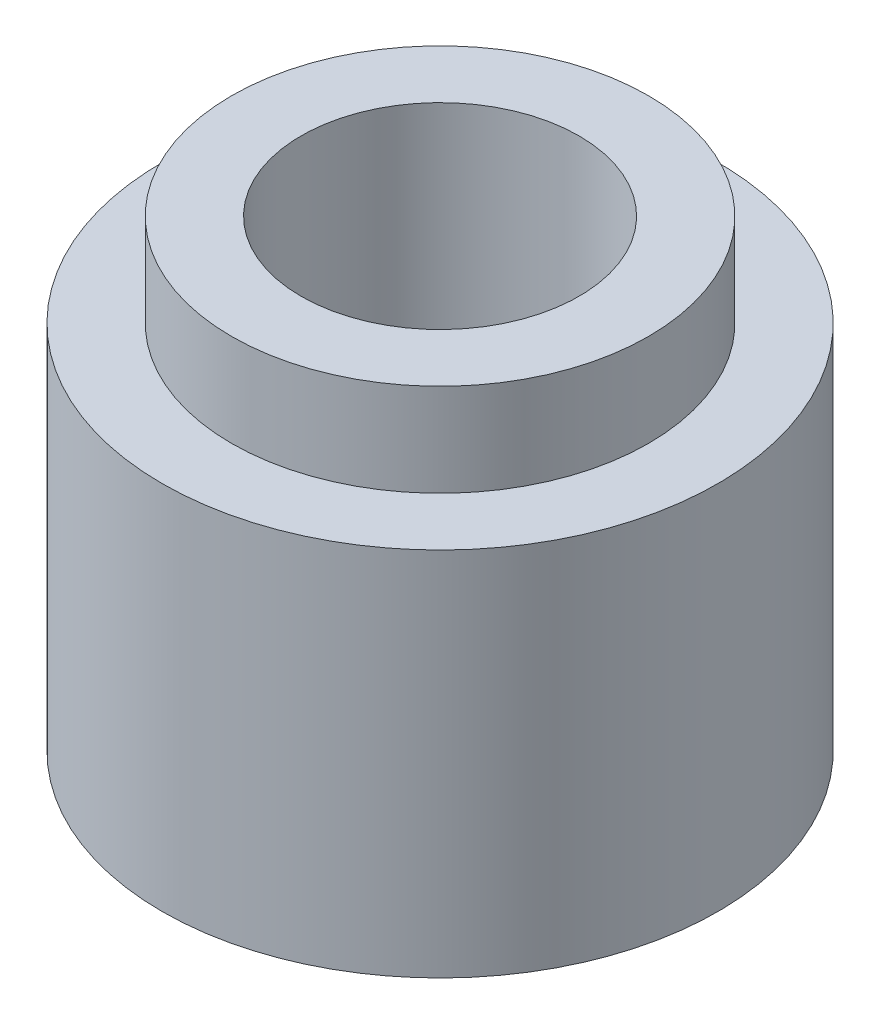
SolidWorks part; units mm, degrees
ref_plane "Спереди" through (0, 0, 0) normal (0, 0, 1) x (1, 0, 0)
ref_plane "Сверху" through (0, 0, 0) normal (0, 1, 0) x (1, 0, 0)
ref_plane "Справа" through (0, 0, 0) normal (1, 0, 0) x (0, 0, -1)
sketch "Эскиз1" plane through (0, 0, 0) normal (0, 1, 0) x (1, 0, 0)
  circle A0 centre (0, 0) radius 3
extrude "Бобышка-Вытянуть1" add sketch "Эскиз1" along normal blind 4
sketch "Эскиз2" plane through (0, 4, 0) normal (0, 1, 0) x (1, 0, 0)
  circle A0 centre (0, 0) radius 2.25
extrude "Бобышка-Вытянуть2" add sketch "Эскиз2" along normal blind 1
sketch "Эскиз3" plane through (0, 0, 0) normal (0, -1, 0) x (1, 0, 0)
  circle A0 centre (0, 0) radius 1.5
extrude "Вырез-Вытянуть1" cut sketch "Эскиз3" against normal up to surface (5 mm away)
